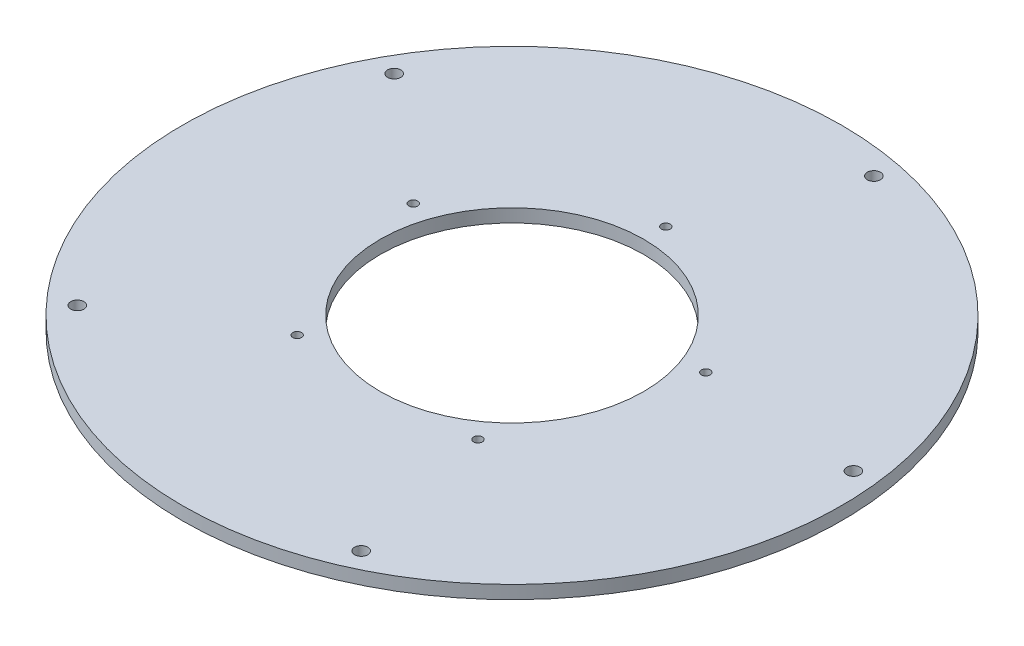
SolidWorks part; units mm, degrees
ref_plane "Plan de face" through (0, 0, 0) normal (0, 0, 1) x (1, 0, 0)
ref_plane "Plan de dessus" through (0, 0, 0) normal (0, 1, 0) x (1, 0, 0)
ref_plane "Plan de droite" through (0, 0, 0) normal (1, 0, 0) x (0, 0, -1)
sketch "Esquisse1" plane through (0, 0, 0) normal (0, 1, 0) x (1, 0, 0)
  line L0 (0, 75) -> (0, 30) construction
  line L1 (0, 0) -> (14.6786, 73.5496) construction
  line L2 (13.7, 68.6463) -> (0, 68.6463) construction
  circle A0 centre (0, 0) radius 75
  circle A1 centre (0, 0) radius 30
  circle A2 centre (13.7, 68.6463) radius 1.5
  circle A3 centre (0, 35) radius 1
  circle A4 centre (69.52, 8.1834) radius 1.5
  circle A5 centre (33.287, 10.8156) radius 1
  circle A6 centre (29.2657, -63.5887) radius 1.5
  circle A7 centre (20.5725, -28.3156) radius 1
  circle A8 centre (-51.4328, -47.4833) radius 1.5
  circle A9 centre (-20.5725, -28.3156) radius 1
  circle A10 centre (-61.0529, 34.2423) radius 1.5
  circle A11 centre (-33.287, 10.8156) radius 1
  circle A12 centre (0, 0) radius 35 construction
  circle A13 centre (0, 0) radius 70 construction
  point P28 (0, 0)
  point P31 (0, 0)
  dimension "D1" = 150
  dimension "D2" = 60
  dimension "D4" = 3
  dimension "D5" = 2
  dimension "D3" = 13.7
  dimension "D6" = 5
  dimension "D8" = 5
  dimension "D7" = 5
  dimension "D9" = 5
extrude "Boss.-Extru.1" add sketch "Esquisse1" along normal blind 3
